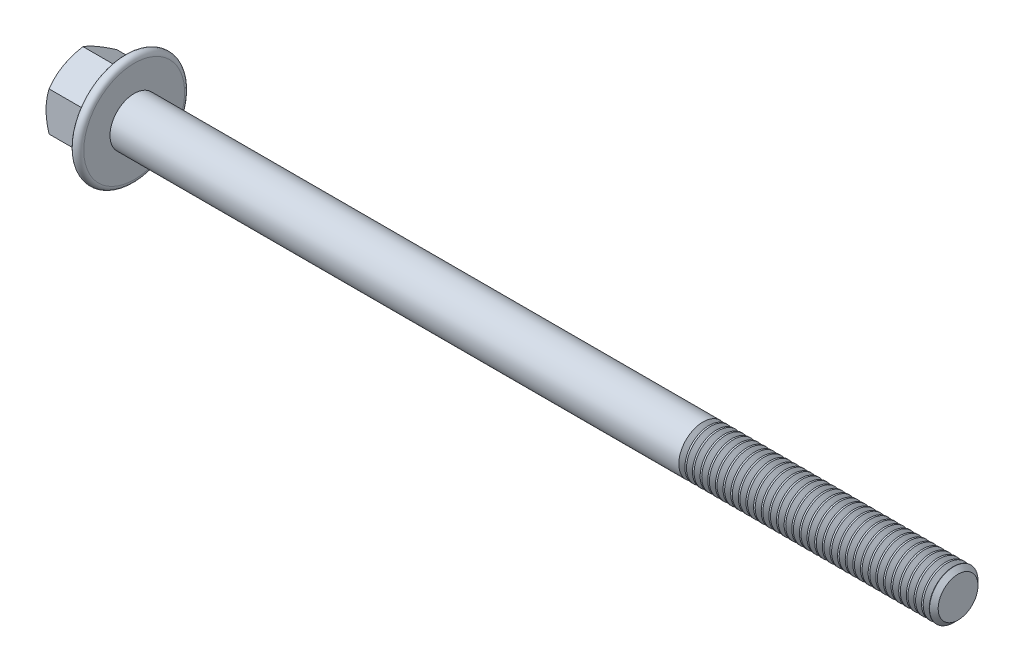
SolidWorks part; units mm, degrees
ref_plane "Plane1" through (0, 0, 0) normal (0, 0, 1) x (1, 0, 0)
ref_plane "Plane2" through (0, 0, 0) normal (0, 1, 0) x (1, 0, 0)
ref_plane "Plane3" through (0, 0, 0) normal (1, 0, 0) x (0, 0, -1)
sketch "Sketch1" plane through (0, 0, 0) normal (1, 0, 0) x (0, 0, -1)
  line L0 (3.5, 2.0207) -> (3.5, -2.0207)
  line L1 (-3.5, 2.0207) -> (-3.5, -2.0207)
  line L2 (3.5, -2.0207) -> (0, -4.0415)
  line L3 (0, -4.0415) -> (-3.5, -2.0207)
  line L4 (3.5, 2.0207) -> (0, 4.0415)
  line L5 (0, 4.0415) -> (-3.5, 2.0207)
  dimension "Width_flats" = 7
  dimension "D2" = 120
  dimension "D3" = 3.5
  dimension "D4" = 3.5
  dimension "D5" = 3.5
extrude "BaseHead" add sketch "Sketch1" along normal blind 5.6
sketch "BodySke" plane through (0, 0, 0) normal (0, 0, 1) x (1, 0, 0)
  line L0 (0, 2.0207) -> (0, -2.0207) construction
  line L1 (0, 0) -> (90.6, 0)
  line L2 (0, 0) -> (0, 2.5)
  line L3 (0, 2.5) -> (90.155, 2.5)
  line L4 (90.6, 0) -> (90.6, 2.055)
  line L5 (5.6, 4.0415) -> (5.6, 2.0207) construction
  line L6 (90.6, 2.055) -> (90.155, 2.5)
  line L7 (0, 0) -> (96.52, 0) construction
  line L8 (90.6, -2.055) -> (90.155, -2.5) construction
  line L9 (0, -2.5) -> (90.155, -2.5) construction
  line L10 (6.4, 15.24) -> (6.4, -1.27) construction
  line L11 (64.6, 15.24) -> (64.6, -1.27) construction
  line L12 (5.6, 2.0207) -> (5.6, -2.0207) construction
  dimension "Length" = 85
  dimension "Body_ch_ang" = 45
  dimension "Diameter" = 5
  dimension "Minor_dia" = 4.11
  dimension "Advance" = 0.8
  dimension "Thread_nom" = 26
revolve "BaseBody" add sketch "BodySke" angle 360 about L7
sketch "Sketch3" plane through (0, 0, 0) normal (0, 0, 1) x (1, 0, 0)
  line L0 (0, 3.5) -> (3.1994, 9.0415)
  line L1 (0, 4.0415) -> (0, 2.0207) construction
  line L2 (3.1994, 9.0415) -> (3.1994, 14.0415)
  line L3 (3.1994, 14.0415) -> (-10, 14.0415)
  line L4 (-10, 14.0415) -> (-10, 3.5)
  line L5 (-10, 3.5) -> (0, 3.5)
  line L6 (0, 0) -> (99.06, 0) construction
  line L7 (5.6, 4.0415) -> (0, 4.0415) construction
  dimension "D1" = 3.5
  dimension "D2" = 5
  dimension "D3" = 10
  dimension "D4" = 5
  dimension "Head_ch_ang" = 30
revolve "HeadChamfer" cut sketch "Sketch3" angle 360 about L6
sketch "Sketch4" plane through (0, 0, 0) normal (0, 0, 1) x (1, 0, 0)
  line L0 (2.6753, 0) -> (4.6302, 5.371)
  line L1 (5.6, 4.0415) -> (5.6, 2.0207) construction
  line L2 (4.6, 34.3444) -> (4.6, 16.9779) construction
  line L3 (5.6, 0) -> (5.6, 5.2)
  line L4 (8.3021, 5.7) -> (20.1618, 5.7) construction
  line L5 (0, 0) -> (95.25, 0) construction
  line L6 (0, 0) -> (96.52, 0) construction
  line L7 (2.6753, 0) -> (5.6, 0)
  line L8 (8.3021, -5.7) -> (20.1618, -5.7) construction
  arc A0 (5.6, 5.2) -> (4.6302, 5.371) centre (5.1, 5.2) ccw
  dimension "D1" = 20
  dimension "Flange_thickness" = 1
  dimension "Flange_dia" = 11.4
revolve "Flange" add sketch "Sketch4" angle 360 about L5
fillet "FlangeHexFillet" radius 0.1 6 edges
fillet "HeadFillet" [suppressed] radius 0.2
sketch "ThdSchSke" plane through (0, 0, 0) normal (0, 0, 1) x (1, 0, 0)
  line L0 (64.6, -2.055) -> (64.2884, -2.5)
  line L1 (64.6, -2.055) -> (64.9116, -2.5)
  line L2 (64.9116, -2.5) -> (64.9116, -3.125)
  line L3 (-3.175, 0) -> (5.1513, 0) construction
  line L5 (64.9116, -3.125) -> (64.2884, -3.125)
  line L6 (64.2884, -3.125) -> (64.2884, -2.5)
  dimension "Thread_minor" = 4.11
  dimension "Diameter" = 5
  dimension "Start" = 64.6
  dimension "SideAngle" = 55
  dimension "VeeAngle" = 70
  dimension "Overcut" = 6.25
revolve "ThreadSchematic" cut sketch "ThdSchSke" angle 360 about L3
pattern_linear "ThdSchPat" count 33 spacing 0.7879 along (1, 0, 0) of "ThreadSchematic"
equation "\"D3@Sketch1\" = \"Width_flats@Sketch1\" / 2"
equation "\"D4@Sketch1\" = \"D3@Sketch1\""
equation "\"D5@Sketch1\" = \"D4@Sketch1\""
equation "\"Thread_minor@ThreadCosmetic\" = \"Minor_dia@BodySke\""
equation "\"D1@Sketch3\" = \"Width_flats@Sketch1\" / 2"
equation "\"Thread_length@ThreadCosmetic\" = ((sgn( (\"Length@BodySke\" - \"Advance@BodySke\" ) - \"Thread_nom@BodySke\" )-1)*( (\"Length@BodySke\" - \"Advance@BodySke\" ) - \"Thread_nom@BodySke\" ))/-2+ \"Thread_nom@BodySke\""
equation "\"Thread_minor@ThdSchSke\" = \"Minor_dia@BodySke\""
equation "\"Diameter@ThdSchSke\" = \"Diameter@BodySke\""
equation "\"Overcut@ThdSchSke\" = \"Diameter@BodySke\" * 1.25"
equation "\"Start@ThdSchSke\" = \"Head_ht@BaseHead\" + \"Length@BodySke\" - \"Thread_length@ThreadCosmetic\"  '---Non-countersunk---"
equation "\"Num_threads@ThdSchPat\" = int( \"Thread_length@ThreadCosmetic\" / \"Advance@BodySke\" + 0.999 )  + 1"
equation "\"Advance@ThdSchPat\" = \"Thread_length@ThreadCosmetic\" /  (\"Num_threads@ThdSchPat\" - 1) 'relax it"
equation "\"Num_threads@ThdSchPat\" = \"Num_threads@ThdSchPat\" - sgn( \"Num_threads@ThdSchPat\" - 1) '---chamfered tips only---"
